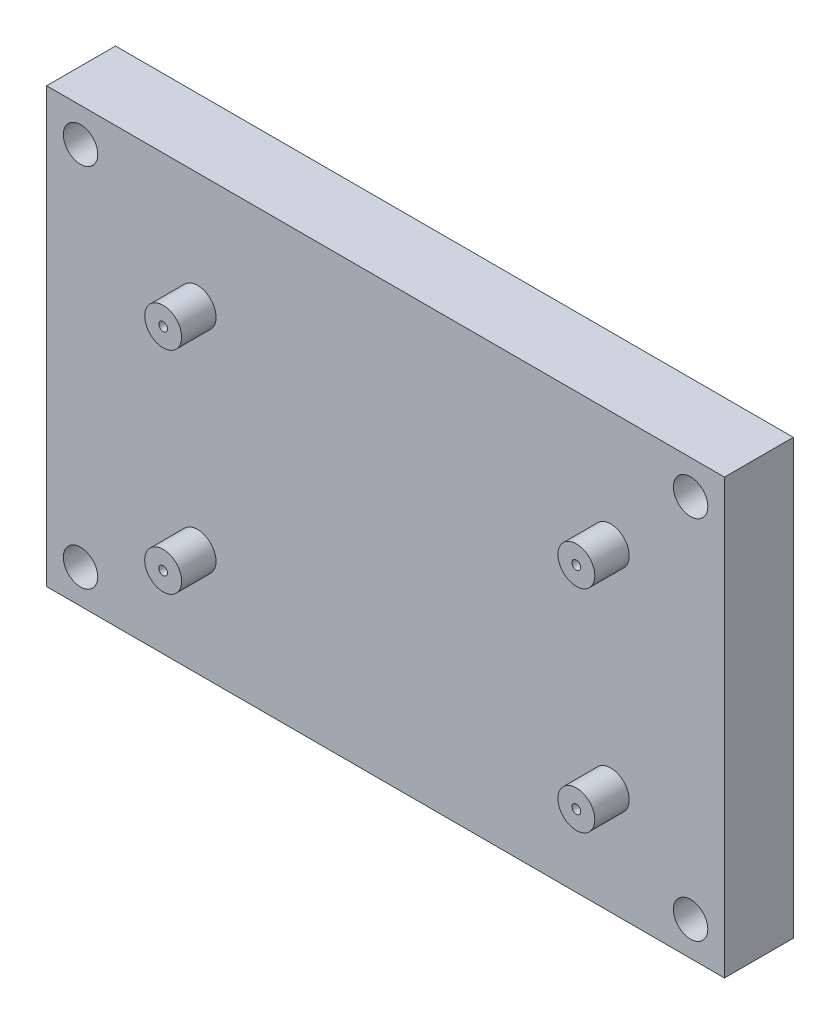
SolidWorks part; units mm, degrees
ref_plane "Front Plane" through (0, 0, 0) normal (0, 0, 1) x (1, 0, 0)
ref_plane "Top Plane" through (0, 0, 0) normal (0, 1, 0) x (1, 0, 0)
ref_plane "Right Plane" through (0, 0, 0) normal (1, 0, 0) x (0, 0, -1)
sketch "Sketch1" plane through (0, 0, 0) normal (0, 0, 1) x (1, 0, 0)
  line L1 (0, 0) -> (125, 0)
  line L2 (0, 0) -> (0, 80)
  line L3 (0, 80) -> (125, 80)
  line L4 (125, 0) -> (125, 80)
  dimension "D1" = 125
  dimension "D2" = 80
extrude "Boss-Extrude1" add sketch "Sketch1" along normal blind 12.7
sketch "Sketch2" plane through (0, 0, 12.7) normal (0, 0, 1) x (1, 0, 0)
  line L0 (0, 80) -> (0, 0) construction
  line L2 (125, 80) -> (0, 80) construction
  line L3 (125, 0) -> (125, 80) construction
  line L4 (0, 0) -> (125, 0) construction
  circle A0 centre (118.75, 73.75) radius 3.175
  circle A1 centre (6.25, 6.25) radius 3.175
  circle A2 centre (118.75, 6.25) radius 3.175
  circle A3 centre (6.25, 73.75) radius 3.175
  point P8 (120.223, 74.5725)
  point P9 (5.8878, 5.2997)
  point P10 (120.223, 5.2997)
  point P15 (7.1638, 80)
  dimension "D1" = 6.25
  dimension "D2" = 6.25
  dimension "D3" = 6.25
  dimension "D4" = 6.25
  dimension "D5" = 6.25
  dimension "D6" = 6.25
  dimension "D7" = 6.25
  dimension "D8" = 6.25
extrude "Cut-Extrude1" cut sketch "Sketch2" against normal through all
sketch "Sketch3" plane through (0, 0, 12.7) normal (0, 0, 1) x (1, 0, 0)
  circle A0 centre (27.8361, 58.6361) radius 3.4019
  circle A1 centre (104.0361, 58.6361) radius 3.4019
  circle A2 centre (27.8333, 19.6561) radius 3.4019
  circle A3 centre (104.0333, 19.6561) radius 3.4019
  point P8 (63.8374, 58.3093)
  point P9 (23.8246, 30.5964)
  point P10 (0, 0)
  point P11 (63.8374, 30.5964)
  point P12 (56.9389, 59.3612)
  point P13 (25.0683, 34.1118)
  point P14 (56.9389, 34.1118)
  dimension "D1" = 76.2
  dimension "D2" = 38.98
  dimension "D3" = 76.2
  dimension "D4" = 38.98
extrude "Boss-Extrude2" add sketch "Sketch3" along normal blind 6.35
sketch "Sketch5" plane through (0, 0, 19.05) normal (0, 0, 1) x (1, 0, 0)
  point P0 (27.8361, 58.6361)
  point P3 (104.0333, 19.6561)
  point P4 (27.8333, 19.6561)
  point P6 (104.0361, 58.6361)
  point P8 (0, 0)
hole_wizard "#52 (0.0635) Diameter Hole1" positions "3DSketch1" profile "Sketch9" hole size "#52" standard "ANSI Inch"
sketch3d "3DSketch1"
  point P0 (27.8361, 58.6361, 19.05)
  point P3 (104.0361, 58.6361, 19.05)
  point P6 (27.8333, 19.6561, 19.05)
  point P9 (104.0333, 19.6561, 19.05)
sketch "Sketch9" plane through (27.8361, 58.6361, 19.05) normal (1, 0, 0) x (0, -1, 0)
  line L0 (0, 0) -> (0, 19.05)
  line L1 (0, 19.05) -> (0.8064, 19.05)
  line L2 (0.8064, 19.05) -> (0.8064, 0)
  line L5 (0.8064, 0) -> (0, 0)
  line L11 (0, -6.35) -> (0, 107.95) construction
  dimension "Thru Hole Dia." = 1.6129
  dimension "Thru Hole Depth" = 19.05
